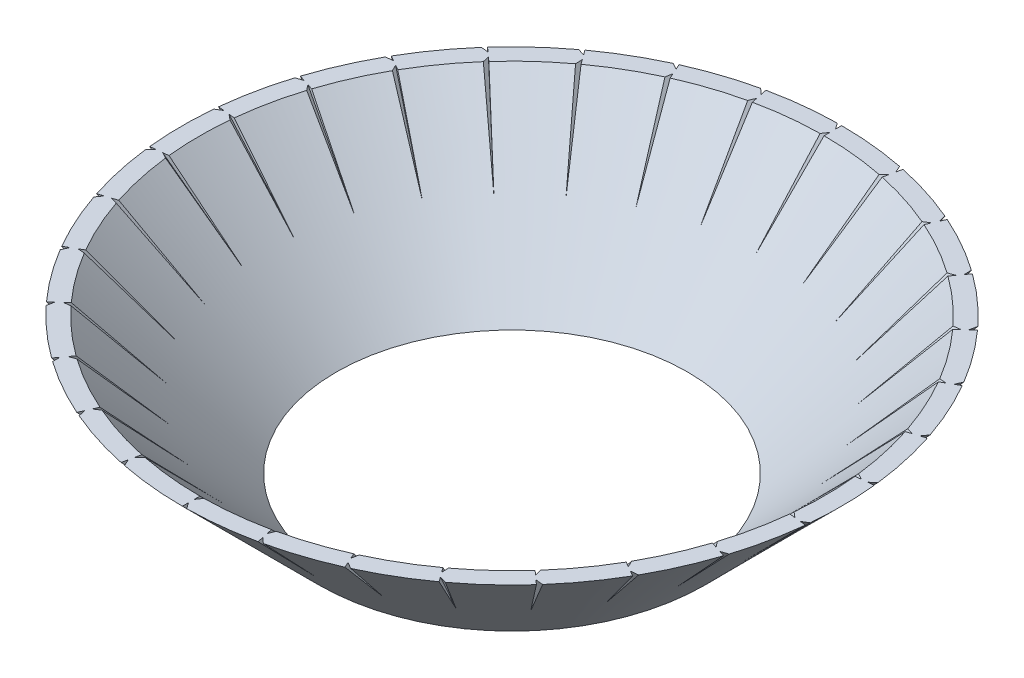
SolidWorks part; units mm, degrees
ref_plane "Plane1" through (0, 0, 0) normal (0, 0, 1) x (1, 0, 0)
ref_plane "Plane2" through (0, 0, 0) normal (0, 1, 0) x (1, 0, 0)
ref_plane "Plane3" through (0, 0, 0) normal (1, 0, 0) x (0, 0, -1)
sketch "Sketch1" plane through (0, 0, 0) normal (1, 0, 0) x (0, 0, -1)
  line L0 (0, -30) -> (0, 30) construction
  line L1 (8.5, 0) -> (15.1, 6.6)
  line L2 (8.5, 0) -> (9.3485, 0)
  line L3 (9.3485, 0) -> (15.9485, 6.6)
  line L4 (15.1, 6.6) -> (15.9485, 6.6)
  dimension "D1" = 45
  dimension "InsideDia" = 17
  dimension "OutsideDia" = 30.2
  dimension "Thickness" = 0.6
revolve "Base-Revolve" add sketch "Sketch1" angle 360 about L0
sketch "Sketch3" plane through (0, 0, 0) normal (1, 0, 0) x (0, 0, -1)
  line L1 (11.8, 3.3) -> (16.4649, 7.6)
  line L3 (8.5, 0) -> (15.1, 6.6) construction
  line L4 (15.9485, 6.6) -> (-15.9485, 6.6) construction
  point P4 (15.38, 6.6)
  dimension "D1" = 3.3
  dimension "D2" = 15.38
  dimension "D3" = 1
ref_plane "Plane4" through (0, 3.3, -11.8) normal (0, 0.6778, -0.7353) x (-1, 0, 0)
sketch "Sketch5" plane through (0, 3.3, -11.8) normal (0, 0.6778, -0.7353) x (-1, 0, 0)
  line L0 (0, 0) -> (0, 1)
  line L1 (0, 1) -> (1, 1)
  line L2 (1, 1) -> (0, 0)
  dimension "D1" = 1
  dimension "D2" = 1
sweep "Cut-Sweep1" cut profiles "Sketch5" path "Sketch3"
ref_plane "Plane6" through (0, 3.3, -12.6485) normal (0, -0.7071, -0.7071) x (1, 0, 0)
ref_plane "Plane7" through (0, -4.4621, -4.4621) normal (0, -0.7071, -0.7071) x (1, 0, 0)
mirror "Mirror2" about plane through (0, -4.4621, -4.4621) normal (0, -0.7071, -0.7071) of "Cut-Sweep1"
pattern_circular "CirPattern1" count 30 over 360 about axis through (0, 0, 0) along (0, 1, 0) of "Mirror2", "Cut-Sweep1"
equation "\"D1@Sketch3\" = ( \"OutsideDia@Sketch1\" - \"InsideDia@Sketch1\" )  / 4"
equation "\"D2@Sketch3\" = \"OutsideDia@Sketch1\" / 2 + (sqr(\"Thickness@Sketch1\" * \"Thickness@Sketch1\" + \"Thickness@Sketch1\" * \"Thickness@Sketch1\") * .33)"
equation "\"D1@Plane7\" = \"Thickness@Sketch1\" / 2"
